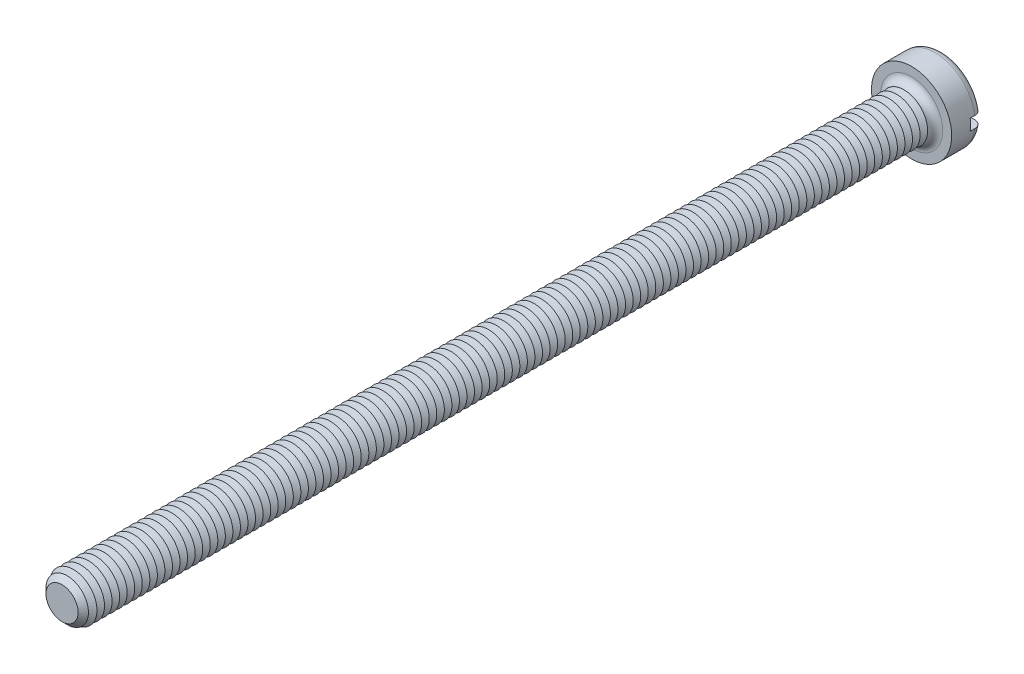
SolidWorks part; units mm, degrees
ref_plane "Front Plane" through (0, 0, 0) normal (0, 0, 1) x (1, 0, 0)
ref_plane "Top Plane" through (0, 0, 0) normal (0, 1, 0) x (1, 0, 0)
ref_plane "Right Plane" through (0, 0, 0) normal (1, 0, 0) x (0, 0, -1)
sketch "Sketch3" plane through (0, 0, 0) normal (0, 0, 1) x (1, 0, 0)
  circle A0 centre (0, 0) radius 4.25
  dimension "D1" = 8.5
extrude "Boss-Extrude2" add sketch "Sketch3" against normal blind 3.3
sketch "Sketch4" plane through (0, 0, 0) normal (0, 0, 1) x (1, 0, 0)
  circle A0 centre (0, 0) radius 2.5
  dimension "D1" = 5
extrude "Boss-Extrude3" add sketch "Sketch4" along normal blind 90
fillet "Fillet1" radius 0.8 2 edges at (4.25, 0, -3.3) (2.5, 0, 0)
chamfer "Chamfer1" distance 0.8 angle 45 1 edges at (2.5, 0, 90)
sketch "Sketch5" plane through (0, 0, 0) normal (1, 0, 0) x (0, 0, -1)
  line L0 (1.6944, 0) -> (-7.6738, 0) construction
sketch "Sketch6" plane through (0, 0, 0) normal (1, 0, 0) x (0, 0, -1)
  line L0 (-0.8, 2.5) -> (-1.2, 1.8072)
  line L1 (-1.2, 1.8072) -> (-1.6, 2.5)
  line L2 (-0.8, 2.5) -> (-89.2, 2.5) construction
  line L3 (-1.6, 2.5) -> (-0.8, 2.5)
  dimension "D1" = 0.8
revolve "Cut-Revolve1" cut sketch "Sketch6" angle 360 about L0
pattern_linear "LPattern1" count 111 spacing 0.8 along (0, 0, 1) of "Cut-Revolve1"
sketch "Sketch8" plane through (0, 0, -3.3) normal (0, 0, -1) x (-1, 0, 0)
  line L1 (4.25, -0.6) -> (-4.25, -0.6)
  line L2 (4.25, -0.6) -> (4.25, 0.6)
  line L3 (4.25, 0.6) -> (-4.25, 0.6)
  line L4 (-4.25, -0.6) -> (-4.25, 0.6)
  line L5 (4.25, -0.6) -> (-4.25, 0.6) construction
  line L6 (4.25, 0.6) -> (-4.25, -0.6) construction
  point P0 (0, 0)
  dimension "D1" = 8.5
  dimension "D2" = 1.2
extrude "Cut-Extrude1" cut sketch "Sketch8" against normal blind 1.3
